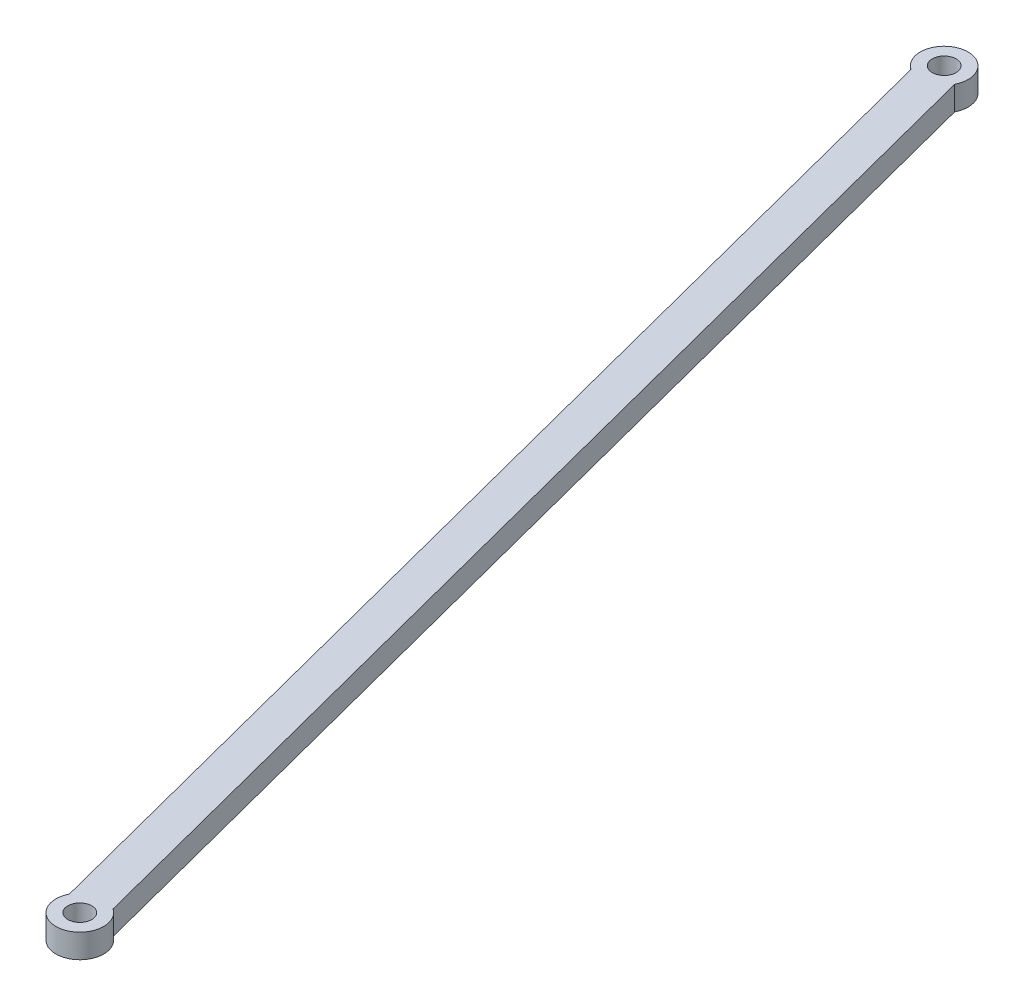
SolidWorks part; units mm, degrees
ref_plane "Vorderseite" through (0, 0, 0) normal (0, 0, 1) x (1, 0, 0)
ref_plane "Oben" through (0, 0, 0) normal (0, 1, 0) x (1, 0, 0)
ref_plane "Rechts" through (0, 0, 0) normal (1, 0, 0) x (0, 0, -1)
ref_plane "Ebene1" through (0, 400, 0) normal (0, 1, 0) x (1, 0, 0)
sketch "Skizze1" plane through (0, 400, 550) normal (0, 1, 0) x (1, 0, 0)
  line L1 (-530, -120) -> (-452, -120)
  line L3 (0, 0) -> (0, 2902.3)
  line L4 (0, 0) -> (0, -120)
  line L5 (0, -120) -> (0, -32.5)
  line L6 (0, -32.5) -> (-126, -32.5)
  line L7 (-530, 0) -> (530, 0) construction
  line L8 (530, 150) -> (530, -150)
  line L9 (-530, 150) -> (-530, -150)
  line L10 (530, -120) -> (452, -120)
  line L11 (-452, -120) -> (0, -120)
  line L12 (0, -120) -> (452, -120)
  line L13 (-530, -1040) -> (530, -1040) construction
  line L14 (0, 0) -> (0, -1040) construction
  line L15 (529.9542, -890) -> (530.0458, -1190)
  line L16 (-530.0526, -867.5292) -> (-529.9474, -1212.4708)
  line L17 (-530.0366, -920) -> (-452.0366, -919.9762)
  line L18 (529.9634, -920) -> (451.9634, -920.0238)
  line L19 (-0.0366, -920) -> (0, -1040)
  line L20 (-0.0099, -1007.5) -> (125.9901, -1007.4615)
  line L21 (-126, -32.5) -> (125.9901, -1007.4615)
  line L22 (-452.0366, -919.9762) -> (-0.0366, -920)
  line L23 (-0.0366, -920) -> (451.9634, -920.0238)
  line L24 (0, -1356) -> (0, -1040)
  line L25 (344.7172, -520) -> (0, -520)
  circle A0 centre (0, 0) radius 7.3181
  point P4 (0, 0)
  point P13 (0, 0)
  point P17 (-530, 0)
  point P19 (530, 0)
  point P30 (-530, -1040)
  point P31 (530, -1040)
  dimension "D3" = 2902.3
  dimension "D5" = 32.5
  dimension "D6" = 120
  dimension "D7" = 1060
  dimension "D8" = 78
  dimension "D9" = 120
  dimension "D10" = 120
  dimension "D11" = 452
  dimension "D14" = 300
  dimension "D15" = 1040
  dimension "D16" = 126
  dimension "D17" = 120
  dimension "D18" = 120
  dimension "D19" = 32.5
  dimension "D20" = 1007
  dimension "D21" = 316
sketch "Skizze2" plane through (0, 400, 0) normal (0, 1, 0) x (1, 0, 0)
  line L0 (-137.2124, -599.0614) -> (108.157, -1548.4072)
  line L2 (137.2025, -1540.9001) -> (-108.1669, -591.5543)
  line L3 (-126, -582.5) -> (125.9901, -1557.4615) construction
  line L4 (-126, -582.5) -> (-123.4976, -592.1818) construction
  line L5 (124.3949, -1551.2899) -> (125.9901, -1557.4615) construction
  circle A0 centre (-126, -582.5) radius 10
  arc A1 (-108.1669, -591.5543) -> (-137.2124, -599.0614) centre (-126, -582.5) ccw
  circle A2 centre (125.9901, -1557.4615) radius 10
  arc A3 (108.157, -1548.4072) -> (137.2025, -1540.9001) centre (125.9901, -1557.4615) ccw
  dimension "D1" = 20
  dimension "D3" = 40
  dimension "D2" = 30
extrude "Aufsatz-Linear austragen1" add sketch "Skizze2" along normal blind 20
